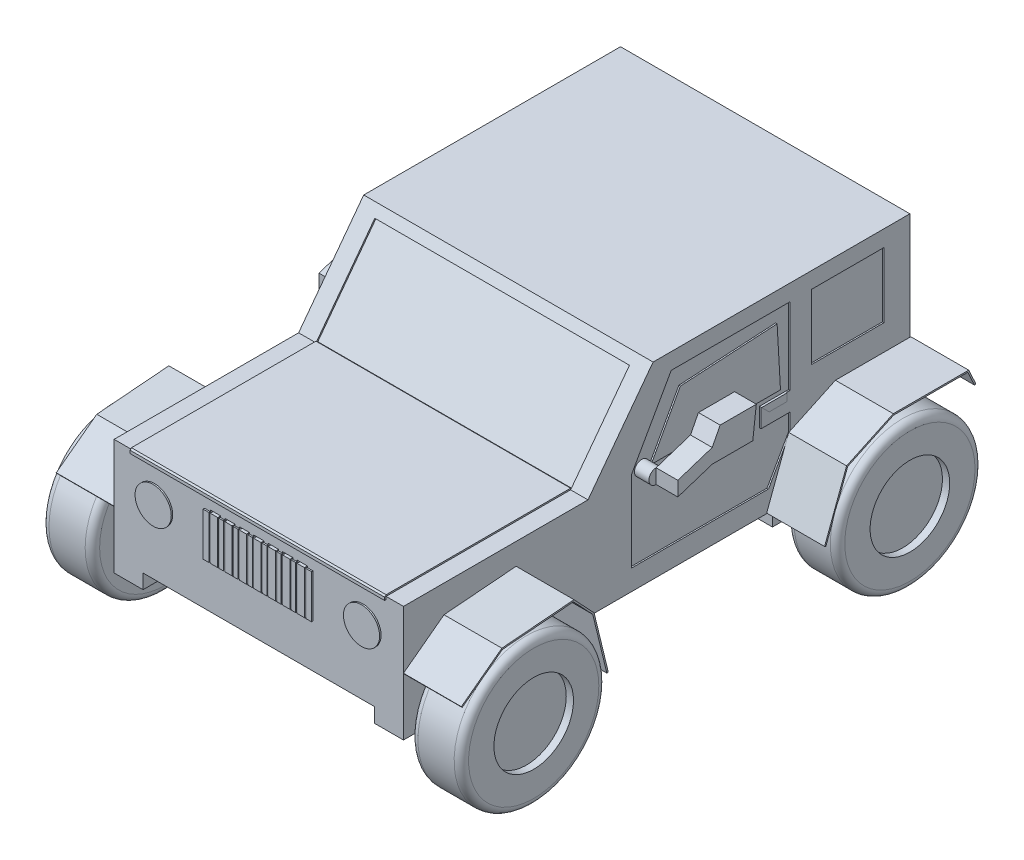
SolidWorks part; units mm, degrees
ref_plane "Front Plane" through (0, 0, 0) normal (0, 0, 1) x (1, 0, 0)
ref_plane "Top Plane" through (0, 0, 0) normal (0, 1, 0) x (1, 0, 0)
ref_plane "Right Plane" through (0, 0, 0) normal (1, 0, 0) x (0, 0, -1)
sketch "Sketch1" plane through (0, 0, 0) normal (1, 0, 0) x (0, 0, -1)
  line L1 (-1750, 100) -> (1750, 100)
  line L2 (-1750, 100) -> (-1750, -100)
  line L3 (-1750, -100) -> (1750, -100)
  line L4 (1750, 100) -> (1750, -100)
  line L5 (-1750, 100) -> (1750, -100) construction
  line L6 (-1750, -100) -> (1750, 100) construction
  circle A0 centre (1300, 0) radius 75
  circle A1 centre (-1300, 0) radius 75
  point P0 (0, 0)
  point P9 (0, 0)
extrude "Boss-Extrude1" add sketch "Sketch1" along normal blind 1000
sketch "Sketch2" plane through (1000, 0, 0) normal (1, 0, 0) x (0, 0, -1)
  circle A0 centre (-1300, 0) radius 75
  circle A1 centre (1300, 0) radius 75
extrude "Boss-Extrude2" add sketch "Sketch2" along normal blind 100 separate body
sketch "Sketch3" plane through (1100, 0, 0) normal (1, 0, 0) x (0, 0, -1)
  circle A0 centre (-1300, 0) radius 500
  circle A1 centre (1300, 0) radius 500
  circle A2 centre (1300, 0) radius 275
  circle A3 centre (-1300, 0) radius 275
extrude "Boss-Extrude3" add sketch "Sketch3" along normal blind 350 separate body
fillet "Fillet1" radius 50 2 edges at (1100, 0, 800) (1450, 0, 800)
fillet "Fillet2" radius 50 2 edges at (1100, 0, -1800) (1450, 0, -1800)
mirror "Mirror3" about plane through (0, 0, 0) normal (1, 0, 0) of "Boss-Extrude1"
sketch "Sketch4" plane through (-1000, 0, 0) normal (-1, 0, 0) x (0, 0, 1)
  circle A0 centre (1300, 0) radius 75
  circle A1 centre (-1300, 0) radius 75
extrude "Boss-Extrude4" add sketch "Sketch4" along normal blind 100 separate body
sketch "Sketch5" plane through (-1100, 0, 0) normal (-1, 0, 0) x (0, 0, 1)
  circle A0 centre (1300, 0) radius 500
  circle A1 centre (1300, 0) radius 275
  circle A2 centre (-1300, 0) radius 500
  circle A3 centre (-1300, 0) radius 275
extrude "Boss-Extrude5" add sketch "Sketch5" along normal blind 350 separate body
fillet "Fillet3" radius 50 2 edges at (-1100, 0, 1800) (-1450, 0, 1800)
fillet "Fillet4" radius 50 2 edges at (-1100, 0, -800) (-1450, 0, -800)
sketch "Sketch8" plane through (1100, 0, 0) normal (1, 0, 0) x (0, 0, -1)
  circle A0 centre (-1300, 0) radius 275
  circle A1 centre (1300, 0) radius 275
extrude "Boss-Extrude6" add sketch "Sketch8" along normal blind 300
sketch "Sketch9" plane through (-1100, 0, 0) normal (-1, 0, 0) x (0, 0, 1)
  circle A0 centre (1300, 0) radius 275
  circle A1 centre (-1300, 0) radius 275
extrude "Boss-Extrude7" add sketch "Sketch9" along normal blind 300
sketch "Sketch10" plane through (-1000, 0, 0) normal (-1, 0, 0) x (0, 0, 1)
  line L0 (-800, 0) -> (800, 0)
  line L1 (800, 0) -> (800, -100)
  line L2 (1750, -100) -> (-1750, -100) construction
  line L3 (800, -100) -> (-800, -100)
  line L4 (-800, -100) -> (-800, 0)
  circle A0 centre (1300, 0) radius 500 construction
  point P7 (0, 0)
extrude "Cut-Extrude3" cut sketch "Sketch10" against normal through all
sketch "Sketch11" plane through (0, 0, 1750) normal (0, 0, 1) x (1, 0, 0)
  line L0 (-800, 0) -> (800, 0)
  line L1 (800, 0) -> (800, -100)
  line L2 (1000, -100) -> (-1000, -100) construction
  line L3 (800, -100) -> (-800, -100)
  line L4 (-800, -100) -> (-800, 0)
  point P4 (0, 0)
extrude "Cut-Extrude4" cut sketch "Sketch11" against normal through all
sketch "Sketch12" plane through (0, 100, 0) normal (0, 1, 0) x (1, 0, 0)
  line L0 (-1000, -24.8548) -> (1000, -24.8548)
  line L2 (-1000, -24.8548) -> (-1000, -1750)
  line L3 (-1000, -1750) -> (1000, -1750)
  line L4 (1000, -24.8548) -> (1000, -1750)
  line L5 (-1000, 1750) -> (1000, -1750) construction
  line L6 (-1000, -1750) -> (1000, 1750) construction
  point P0 (0, 0)
extrude "Boss-Extrude8" add sketch "Sketch12" along normal blind 600
sketch "Sketch13" plane through (0, 100, 0) normal (0, 1, 0) x (1, 0, 0)
  line L0 (-1000, -24.8548) -> (-1000, 1750)
  line L1 (-1000, 1750) -> (1000, 1750)
  line L2 (1000, 1750) -> (-1000, 1750) construction
  line L3 (1000, 1750) -> (1000, -24.8548)
  line L4 (1000, -24.8548) -> (-1000, -24.8548)
extrude "Boss-Extrude9" add sketch "Sketch13" along normal blind 1200
sketch "Sketch14" plane through (1000, 0, 0) normal (1, 0, 0) x (0, 0, -1)
  line L0 (-24.8548, 1300) -> (-24.8548, 700)
  line L1 (-24.8548, 700) -> (-474.8548, 700)
  line L2 (-1750, 700) -> (-24.8548, 700) construction
  line L3 (-474.8548, 700) -> (-24.8548, 1300)
extrude "Boss-Extrude10" add sketch "Sketch14" against normal blind 2000
sketch "Sketch15" plane through (0, 0, 1750) normal (0, 0, 1) x (1, 0, 0)
  line L0 (0, 0) -> (0, 450) construction
  line L3 (-375, 600) -> (375, 600)
  line L4 (-375, 600) -> (-375, 300)
  line L5 (-375, 300) -> (375, 300)
  line L6 (375, 600) -> (375, 300)
  line L7 (-375, 600) -> (375, 300) construction
  line L8 (-375, 300) -> (375, 600) construction
  circle A0 centre (720, 450) radius 125
  circle A1 centre (-720, 450) radius 125
  point P6 (0, 450)
extrude "Boss-Extrude11" add sketch "Sketch15" along normal blind 10
sketch "Sketch16" plane through (0, 0, 1760) normal (0, 0, 1) x (1, 0, 0)
  line L0 (-375, 600) -> (-375, 300)
  line L1 (-375, 300) -> (375, 300)
  line L2 (375, 300) -> (375, 600)
  line L3 (375, 600) -> (-375, 600)
  line L4 (-375, 600) -> (-325, 600)
  line L5 (-325, 600) -> (-325, 300)
  line L6 (-325, 300) -> (-275, 300)
  line L7 (-275, 300) -> (-275, 600)
  line L8 (-275, 600) -> (-225, 600)
  line L9 (-225, 600) -> (-225, 300)
  line L10 (-225, 300) -> (-175, 300)
  line L11 (-175, 300) -> (-175, 600)
  line L12 (-175, 600) -> (-125, 600)
  line L13 (-125, 600) -> (-125, 300)
  line L14 (-125, 300) -> (-75, 300)
  line L15 (-75, 300) -> (-75, 600)
  line L16 (-75, 600) -> (-25, 600)
  line L17 (-25, 600) -> (-25, 300)
  line L18 (-25, 300) -> (25, 300)
  line L19 (25, 300) -> (25, 600)
  line L20 (25, 600) -> (75, 600)
  line L21 (75, 600) -> (75, 300)
  line L22 (75, 300) -> (125, 300)
  line L23 (125, 300) -> (125, 600)
  line L24 (125, 600) -> (175, 600)
  line L25 (175, 600) -> (175, 300)
  line L26 (175, 300) -> (225, 300)
  line L27 (225, 300) -> (225, 600)
  line L28 (225, 600) -> (275, 600)
  line L29 (275, 600) -> (275, 300)
  line L30 (275, 300) -> (325, 300)
  line L31 (325, 300) -> (325, 600)
extrude "Cut-Extrude-Thin1" cut sketch "Sketch16" against normal blind 100 thin contours L1 L31 L3 L29 | L1 L27 L3 L25 | L1 L23 L3 L21 | L1 L19 L3 L17 | L1 L15 L3 L13 | L1 L11 L3 L9 | L1 L7 L3 L5
sketch "Sketch17" plane through (0, 0, 1750) normal (0, 0, 1) x (1, 0, 0)
  line L0 (-375, 600) -> (375, 600)
  line L1 (375, 600) -> (375, 300)
  line L2 (375, 300) -> (-375, 300)
  line L3 (-375, 300) -> (-375, 600)
extrude "Boss-Extrude12" add sketch "Sketch17" along normal blind 5
sketch "Sketch18" plane through (0, 0, 0) normal (0, -1, 0) x (1, 0, 0)
  line L1 (-100, 100) -> (100, 100)
  line L2 (-100, 100) -> (-100, -100)
  line L3 (-100, -100) -> (100, -100)
  line L4 (100, 100) -> (100, -100)
  line L5 (-100, 100) -> (100, -100) construction
  line L6 (-100, -100) -> (100, 100) construction
  point P0 (0, 0)
extrude "Cut-Extrude6" cut sketch "Sketch18" against normal blind 50
sketch "Sketch19" plane through (0, 50, 0) normal (0, -1, 0) x (1, 0, 0)
  line L5 (-75, 75) -> (75, -75) construction
  line L6 (-75, -75) -> (75, 75) construction
  circle A0 centre (75, 75) radius 5
  circle A1 centre (-75, 75) radius 5
  circle A2 centre (-75, -75) radius 5
  circle A3 centre (75, -75) radius 5
  point P0 (0, 0)
extrude "Cut-Extrude7" cut sketch "Sketch19" against normal blind 10
sketch "Sketch20" plane through (1000, 0, 0) normal (1, 0, 0) x (0, 0, -1)
  line L0 (920.479, 1187.6385) -> (1070.479, 1187.6385) construction
  line L1 (-174.8548, 700) -> (100.479, 1187.6385)
  line L2 (100.479, 1187.6385) -> (920.479, 1187.6385)
  line L3 (920.479, 1187.6385) -> (920.479, 402.6385)
  line L4 (920.479, 402.6385) -> (772.9788, 141.4036)
  line L5 (772.9788, 141.4036) -> (-174.8548, 141.4036)
  line L6 (-174.8548, 141.4036) -> (-174.8548, 700)
  line L7 (1070.479, 1187.6385) -> (1070.479, 737.6385)
  line L8 (1070.479, 737.6385) -> (1570.479, 737.6385)
  line L9 (1570.479, 737.6385) -> (1570.479, 1187.6385)
  line L10 (1570.479, 1187.6385) -> (1070.479, 1187.6385)
sketch "Sketch21" plane through (-1000, 0, 0) normal (-1, 0, 0) x (0, 0, 1)
  line L0 (-1570.479, 1187.6385) -> (-1570.479, 737.6385)
  line L1 (-1570.479, 737.6385) -> (-1070.479, 737.6385)
  line L2 (-1070.479, 737.6385) -> (-1070.479, 1187.6385)
  line L3 (-1070.479, 1187.6385) -> (-1570.479, 1187.6385)
  line L4 (-920.479, 1187.6385) -> (-920.479, 402.6385)
  line L5 (-920.479, 402.6385) -> (-772.9788, 141.4036)
  line L6 (-772.9788, 141.4036) -> (174.8548, 141.4036)
  line L7 (174.8548, 141.4036) -> (174.8548, 700)
  line L8 (174.8548, 700) -> (-100.479, 1187.6385)
  line L9 (-100.479, 1187.6385) -> (-920.479, 1187.6385)
extrude "Cut-Extrude8" cut sketch "Sketch21" against normal blind 10
extrude "Cut-Extrude9" cut sketch "Sketch20" against normal blind 10
sketch "Sketch22" plane through (0, 700, 0) normal (0, 1, 0) x (1, 0, 0)
  line L0 (-880, -1750) -> (880, -1750)
  line L1 (-1000, -1750) -> (1000, -1750) construction
  line L2 (880, -1750) -> (880, -474.8548)
  line L3 (-1000, -474.8548) -> (1000, -474.8548) construction
  line L4 (880, -474.8548) -> (-880, -474.8548)
  line L5 (-880, -474.8548) -> (-880, -1750)
  point P5 (0, -1750)
extrude "Boss-Extrude13" add sketch "Sketch22" along normal blind 10
sketch "Sketch23" plane through (0, 0, 1750) normal (0, 0, 1) x (1, 0, 0)
  line L0 (-880, 700) -> (-880, 680)
  line L1 (-880, 680) -> (880, 680)
  line L2 (880, 680) -> (880, 700)
  line L3 (880, 700) -> (-880, 700)
extrude "Boss-Extrude14" add sketch "Sketch23" along normal blind 10
sketch "Sketch24" plane through (880, 0, 0) normal (1, 0, 0) x (0, 0, -1)
  line L0 (-1750, 700) -> (-1760, 700)
  line L1 (-1760, 700) -> (-1750, 710)
  line L2 (-1750, 710) -> (-1750, 700)
extrude "Boss-Extrude15" add sketch "Sketch24" against normal blind 1760
sketch "Sketch25" plane through (1000, 0, 0) normal (1, 0, 0) x (0, 0, -1)
  line L0 (920.479, 402.6385) -> (1237.5034, 550.9473)
  line L1 (1237.5034, 550.9473) -> (1750, 550.9473)
  line L2 (1750, -100) -> (1750, 1300) construction
  line L3 (1750, 550.9473) -> (1796.6113, 451.311)
  line L4 (920.479, 402.6385) -> (769.5411, 0)
  line L5 (800, 0) -> (-800, 0) construction
  line L6 (-1750, 300) -> (-1469.9161, 509.8881)
  line L7 (-1750, 700) -> (-1750, -100) construction
  line L8 (-1469.9161, 509.8881) -> (-971.6048, 550.9462)
  line L9 (-971.6048, 550.9462) -> (-832.8284, 403.2281)
  line L10 (-832.8284, 403.2281) -> (-734.6852, 0)
sketch "Sketch26" plane through (-1000, 0, 0) normal (-1, 0, 0) x (0, 0, 1)
  line L0 (-1796.6113, 451.311) -> (-1750, 550.9473)
  line L1 (-1750, 550.9473) -> (-1237.5034, 550.9473)
  line L2 (-1237.5034, 550.9473) -> (-920.479, 402.6385)
  line L3 (-920.479, 402.6385) -> (-769.5411, 0)
  line L4 (734.6852, 0) -> (832.8284, 403.2281)
  line L5 (832.8284, 403.2281) -> (971.6048, 550.9462)
  line L6 (971.6048, 550.9462) -> (1469.9161, 509.8881)
  line L7 (1469.9161, 509.8881) -> (1750, 300)
extrude "Extrude-Thin2" add sketch "Sketch26" along normal blind 400 thin
extrude "Extrude-Thin3" add sketch "Sketch25" along normal blind 400 thin
sketch "Sketch27" plane through (0, 479.9303, 639.9071) normal (0, 0.6, 0.8) x (1, 0, 0)
  line L0 (-880, 283.0871) -> (880, 283.0871)
  line L1 (880, 283.0871) -> (-880, 283.0871) construction
  line L2 (880, 283.0871) -> (880, 953.0871)
  line L3 (880, 953.0871) -> (-880, 953.0871)
  line L4 (-880, 953.0871) -> (-880, 283.0871)
  point P5 (0, 283.0871)
extrude "Cut-Extrude11" cut sketch "Sketch27" against normal blind 10
sketch "Sketch28" plane through (0, 0, -1750) normal (0, 0, -1) x (-1, 0, 0)
  line L0 (0, 0) -> (0, 632.7374) construction
  line L1 (-800, 632.7374) -> (800, 632.7374)
  line L2 (-800, 1265.4748) -> (800, 1265.4748)
  line L3 (848.2294, 841.5563) -> (976.2085, 841.5563)
  line L4 (848.2294, 841.5563) -> (848.2294, 423.9185)
  line L5 (848.2294, 423.9185) -> (976.2085, 423.9185)
  line L6 (976.2085, 841.5563) -> (976.2085, 423.9185)
  line L7 (848.2294, 841.5563) -> (976.2085, 423.9185) construction
  line L8 (848.2294, 423.9185) -> (976.2085, 841.5563) construction
  line L9 (-972.2189, 842.7374) -> (-852.2189, 842.7374)
  line L10 (-972.2189, 842.7374) -> (-972.2189, 422.7374)
  line L11 (-972.2189, 422.7374) -> (-852.2189, 422.7374)
  line L12 (-852.2189, 842.7374) -> (-852.2189, 422.7374)
  line L13 (-972.2189, 842.7374) -> (-852.2189, 422.7374) construction
  line L14 (-972.2189, 422.7374) -> (-852.2189, 842.7374) construction
  line L15 (-800, 1265.4748) -> (-800, 632.7374)
  line L17 (800, 1265.4748) -> (800, 632.7374)
  line L18 (-800, 1265.4748) -> (800, 0) construction
  line L19 (-800, 0) -> (800, 1265.4748) construction
  point P6 (0, 632.7374)
extrude "Cut-Extrude12" cut sketch "Sketch28" against normal blind 10
sketch "Sketch29" plane through (-990, 0, 0) normal (-1, 0, 0) x (0, 0, 1)
  line L0 (38.1588, 693.5127) -> (-163.4002, 1061.9879)
  line L1 (-163.4002, 1061.9879) -> (-832.307, 1100.2477)
  line L2 (-832.307, 1100.2477) -> (-855.5712, 693.5127)
  line L3 (-855.5712, 693.5127) -> (38.1588, 693.5127)
sketch "Sketch30" plane through (990, 0, 0) normal (1, 0, 0) x (0, 0, -1)
  line L0 (-38.1588, 693.5127) -> (163.4002, 1061.9879)
  line L1 (163.4002, 1061.9879) -> (832.307, 1100.2477)
  line L2 (832.307, 1100.2477) -> (855.5712, 693.5127)
  line L3 (855.5712, 693.5127) -> (-38.1588, 693.5127)
extrude "Boss-Extrude16" add sketch "Sketch30" along normal blind 10
extrude "Boss-Extrude17" add sketch "Sketch29" along normal blind 10
sketch "Sketch31" plane through (990, 0, 0) normal (1, 0, 0) x (0, 0, -1)
  line L0 (920.479, 657.4386) -> (720.479, 657.4386)
  line L1 (920.479, 402.6385) -> (920.479, 1187.6385) construction
  line L2 (720.479, 657.4386) -> (720.479, 527.4386)
  line L3 (720.479, 527.4386) -> (920.479, 527.4386)
  line L4 (920.479, 402.6385) -> (920.479, 1187.6385) construction
  line L5 (920.479, 527.4386) -> (920.479, 657.4386)
sketch "Sketch32" plane through (-990, 0, 0) normal (-1, 0, 0) x (0, 0, 1)
  line L0 (-920.479, 657.4386) -> (-920.479, 527.4386)
  line L1 (-920.479, 527.4386) -> (-720.479, 527.4386)
  line L2 (-720.479, 527.4386) -> (-720.479, 657.4386)
  line L3 (-720.479, 657.4386) -> (-920.479, 657.4386)
extrude "Boss-Extrude18" add sketch "Sketch32" along normal blind 10
extrude "Boss-Extrude19" add sketch "Sketch31" along normal blind 10
sketch "Sketch36" plane through (1000, 0, 0) normal (1, 0, 0) x (0, 0, -1)
  line L0 (720.479, 657.4386) -> (772.4107, 605.5069)
  line L1 (772.4107, 605.5069) -> (896.4907, 605.5069)
  line L2 (896.4907, 605.5069) -> (896.4907, 657.4386)
  line L3 (920.479, 657.4386) -> (720.479, 657.4386) construction
  line L4 (896.4907, 657.4386) -> (720.479, 657.4386)
sketch "Sketch37" plane through (-1000, 0, 0) normal (-1, 0, 0) x (0, 0, 1)
  line L0 (-720.479, 657.4386) -> (-896.4907, 657.4386)
  line L1 (-896.4907, 657.4386) -> (-896.4907, 605.5069)
  line L2 (-896.4907, 605.5069) -> (-772.4107, 605.5069)
  line L3 (-772.4107, 605.5069) -> (-720.479, 657.4386)
extrude "Boss-Extrude20" add sketch "Sketch37" along normal blind 5
extrude "Boss-Extrude21" add sketch "Sketch36" along normal blind 5
sketch "Sketch38" plane through (-990, 0, 0) normal (-1, 0, 0) x (0, 0, 1)
  circle A0 centre (93.9098, 696.7922) radius 50
sketch "Sketch39" plane through (990, 0, 0) normal (1, 0, 0) x (0, 0, -1)
  circle A0 centre (-93.9098, 696.7922) radius 50
extrude "Boss-Extrude22" add sketch "Sketch39" along normal blind 100
extrude "Boss-Extrude23" add sketch "Sketch38" along normal blind 100
sketch "Sketch40" plane through (-1090, 0, 0) normal (-1, 0, 0) x (0, 0, 1)
  line L0 (93.9098, 746.7922) -> (-143.7993, 824.2155)
  line L1 (93.9098, 646.7922) -> (-143.7993, 724.2155)
  line L2 (-143.7993, 724.2155) -> (-143.7993, 824.2155)
  line L3 (93.9098, 746.7922) -> (93.9098, 646.7922)
  line L4 (-143.7993, 824.2155) -> (-198.5106, 931.0175)
  line L5 (-198.5106, 931.0175) -> (-448.5106, 931.0175)
  line L6 (-448.5106, 931.0175) -> (-424.2467, 724.2155)
  line L7 (-424.2467, 724.2155) -> (-143.7993, 724.2155)
  circle A0 centre (93.9098, 696.7922) radius 50 construction
  circle A1 centre (93.9098, 696.7922) radius 50 construction
sketch "Sketch41" plane through (1090, 0, 0) normal (1, 0, 0) x (0, 0, -1)
  line L0 (-93.9098, 646.7922) -> (-93.9098, 746.7922)
  line L1 (-93.9098, 746.7922) -> (143.7993, 824.2155)
  line L2 (143.7993, 824.2155) -> (198.5106, 931.0175)
  line L3 (198.5106, 931.0175) -> (448.5106, 931.0175)
  line L4 (448.5106, 931.0175) -> (424.2467, 724.2155)
  line L5 (424.2467, 724.2155) -> (143.7993, 724.2155)
  line L6 (143.7993, 724.2155) -> (-93.9098, 646.7922)
  line L7 (143.7993, 824.2155) -> (143.7993, 724.2155)
extrude "Boss-Extrude24" add sketch "Sketch41" along normal blind 150 contours L2 L7 L5 L4 L3 | L7 L1 L6 M1 | L6 L0 M1
extrude "Boss-Extrude25" add sketch "Sketch40" along normal blind 150 contours L6 L7 L2 L4 L5 | L2 L1 L0 M1 | L3 L1 M1
